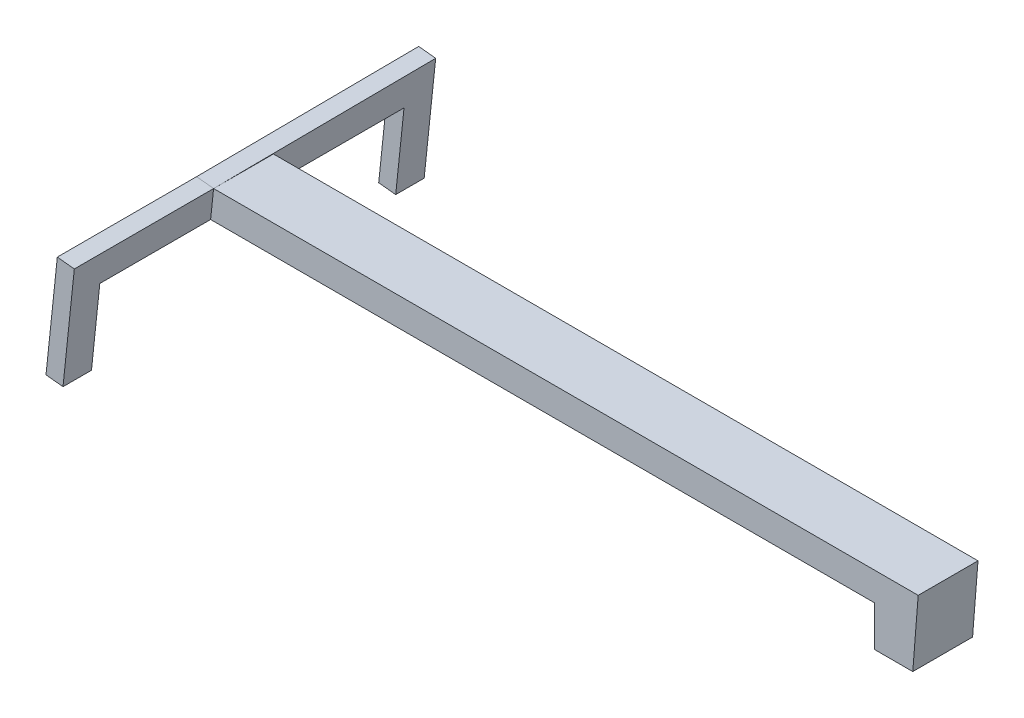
SolidWorks part; units mm, degrees
ref_plane "Front Plane" through (0, 0, 0) normal (0, 0, 1) x (1, 0, 0)
ref_plane "Top Plane" through (0, 0, 0) normal (0, 1, 0) x (1, 0, 0)
ref_plane "Right Plane" through (0, 0, 0) normal (1, 0, 0) x (0, 0, -1)
sketch "Sketch1" plane through (0, 0, 0) normal (0, 0, 1) x (1, 0, 0)
  line L1 (124, -12.07) -> (-124, -12.07)
  line L2 (124, -12.07) -> (124, 12.07)
  line L3 (124, 12.07) -> (-124, 12.07)
  line L4 (-124, -12.07) -> (-124, 12.07)
  line L5 (124, -12.07) -> (-124, 12.07) construction
  line L6 (124, 12.07) -> (-124, -12.07) construction
  point P0 (0, 0)
  dimension "D1" = 248
  dimension "D2" = 24.14
extrude "Boss-Extrude1" add sketch "Sketch1" along normal blind 21
sketch "Sketch3" plane through (0, 0, 21) normal (0, 0, 1) x (1, 0, 0)
  line L0 (124, 12.07) -> (124, -12.07)
  line L1 (124, -12.07) -> (125.8999, 12.07)
  line L2 (125.8999, 12.07) -> (124, 12.07)
  dimension "D1" = 4.5
extrude "Boss-Extrude3" add sketch "Sketch3" against normal up to surface (21 mm away)
sketch "Sketch4" plane through (0, 0, 21) normal (0, 0, 1) x (1, 0, 0)
  line L0 (-124, 12.07) -> (-124, -12.07)
  line L1 (-124, -12.07) -> (-121.4628, 12.07)
  line L2 (125.8999, 12.07) -> (-124, 12.07) construction
  line L3 (-121.4628, 12.07) -> (-124, 12.07)
  dimension "D1" = 6
extrude "Cut-Extrude1" cut sketch "Sketch4" against normal through all
sketch "Sketch5" plane through (-121.3904, 12.7586, 0) normal (-0.9945, 0.1045, 0) x (0, 0, 1)
  line L0 (21, -0.6924) -> (69.9, -0.6924)
  line L1 (69.9, -0.6924) -> (69.9, -38.6924)
  line L2 (69.9, -38.6924) -> (-56.9, -38.6924)
  line L3 (-56.9, -38.6924) -> (-56.9, 0)
  line L4 (-56.9, 0) -> (21, -0.6924)
  dimension "D1" = 48.9
  dimension "D2" = 38
  dimension "D3" = 126.8
extrude "Boss-Extrude4" add sketch "Sketch5" along normal blind 6
sketch "Sketch6" plane through (-127.3575, 13.3858, 0) normal (-0.9945, 0.1045, 0) x (0, 0, 1)
  line L0 (-56.9, -38.6924) -> (69.9, -38.6924) construction
  line L1 (-46.9, -38.6924) -> (59.9, -38.6924)
  line L2 (-46.9, -38.6924) -> (-46.9, -10.6924)
  line L3 (-46.9, -10.6924) -> (59.9, -10.6924)
  line L4 (59.9, -38.6924) -> (59.9, -10.6924)
  dimension "D1" = 10
  dimension "D2" = 10
  dimension "D3" = 10
extrude "Cut-Extrude2" cut sketch "Sketch6" against normal up to surface (6 mm away)
sketch "Sketch7" plane through (0, 0, 21) normal (0, 0, 1) x (1, 0, 0)
  line L0 (-122.5081, 2.1248) -> (110.4784, 2.1248)
  line L1 (110.4784, 2.1248) -> (110.4784, -12.07)
  line L2 (-124, -12.07) -> (124, -12.07) construction
  line L3 (110.4784, -12.07) -> (-124, -12.07)
  line L4 (-124, -12.07) -> (-122.5081, 2.1248)
extrude "Cut-Extrude3" cut sketch "Sketch7" against normal through all
